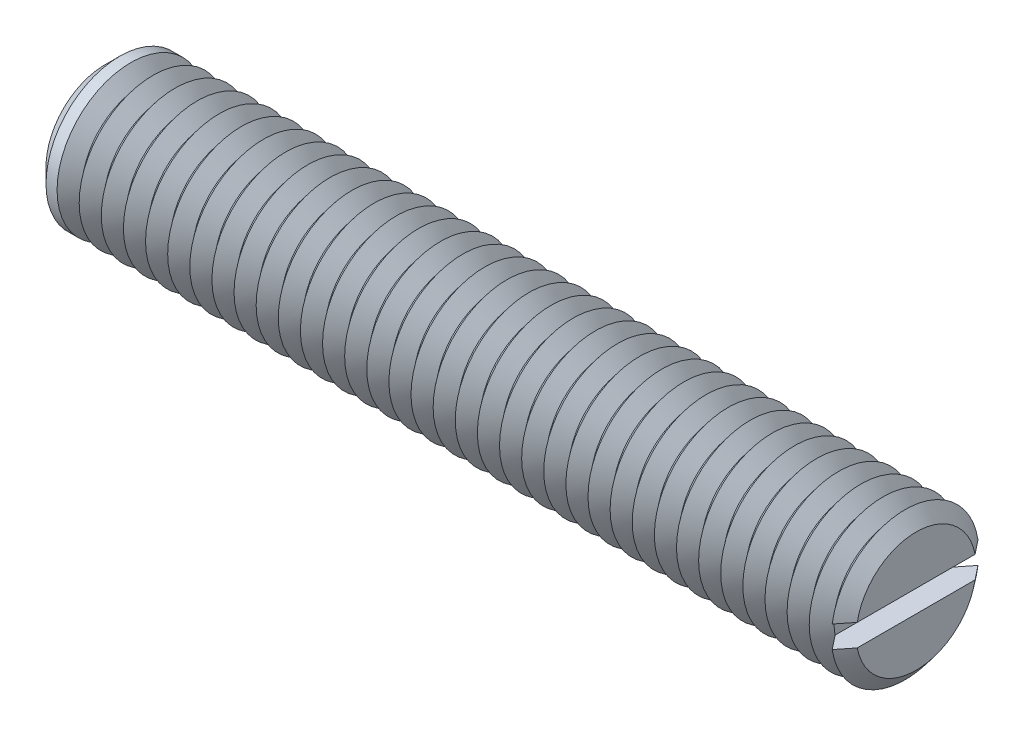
SolidWorks part; units mm, degrees
ref_plane "Front Plane" through (0, 0, 0) normal (0, 0, 1) x (1, 0, 0)
ref_plane "Top Plane" through (0, 0, 0) normal (0, 1, 0) x (1, 0, 0)
ref_plane "Right Plane" through (0, 0, 0) normal (1, 0, 0) x (0, 0, -1)
sketch "Sketch1" plane through (0, 0, 0) normal (1, 0, 0) x (0, 0, -1)
  circle A0 centre (0, 0) radius 5
  dimension "D1" = 10
extrude "Extrude1" add sketch "Sketch1" along normal mid plane 55
sketch "Sketch2" plane through (0, 0, 0) normal (0, 0, 1) x (1, 0, 0)
  line L0 (27.5, 0.75) -> (26, 0.75)
  line L1 (27.5, -5) -> (27.5, 5) construction
  line L2 (26, 0.75) -> (26, -0.75)
  line L3 (0, 0) -> (50000, 0) construction
  line L4 (27.5, -0.75) -> (26, -0.75)
  line L5 (27.5, -0.75) -> (27.5, 0.75)
  point P9 (26, 0)
  dimension "D1" = 1.5
extrude "Extrude2" cut sketch "Sketch2" against normal mid plane 15
chamfer "Chamfer1" distance 1 angle 45 1 edges at (-27.5, 0, -5)
sketch "Sketch3" plane through (0, 0, 0) normal (0, 0, 1) x (1, 0, 0)
  line L0 (0, 0) -> (30.9602, 0) construction
  line L1 (26.75, -5) -> (28.25, -5)
  line L2 (-26.5, -5) -> (27.5, -5) construction
  line L3 (28.25, -5) -> (27.5, -4.0633)
  line L4 (27.5, -5) -> (27.5, -0.75) construction
  line L5 (27.5, -4.0633) -> (26.75, -5)
  dimension "D1" = 1.5
  dimension "D2" = 1.2
revolve "Cut-Revolve1" cut sketch "Sketch3" angle 360 about L0
pattern_linear "LPattern1" count 36 spacing 1.5 along (-1, 0, 0) of "Cut-Revolve1"
equation "\"D2@Sketch3\" = \"D1@Sketch3\"*0.8"
